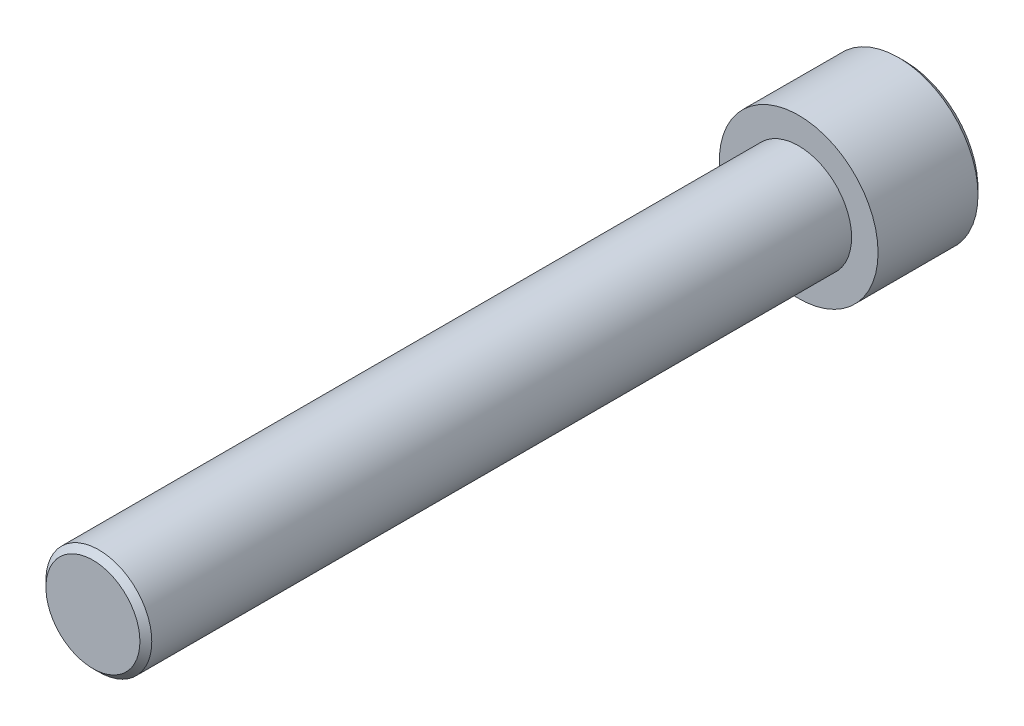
SolidWorks part; units mm, degrees
ref_plane "Front Plane" through (0, 0, 0) normal (0, 0, 1) x (1, 0, 0)
ref_plane "Top Plane" through (0, 0, 0) normal (0, 1, 0) x (1, 0, 0)
ref_plane "Right Plane" through (0, 0, 0) normal (1, 0, 0) x (0, 0, -1)
sketch "Sketch1" plane through (0, 0, 0) normal (0, 1, 0) x (1, 0, 0)
  line L0 (0, -63.5) -> (4.7625, -63.5)
  line L1 (4.7625, -63.5) -> (4.7625, 0)
  line L2 (4.7625, 0) -> (7.1438, 0)
  line L3 (7.1438, 0) -> (7.1438, 9.525)
  line L4 (7.1438, 9.525) -> (0, 9.525)
  line L5 (0, -63.5) -> (0, 0)
  line L6 (0, 0) -> (0, 9.525)
  dimension "D1" = 4.7625
  dimension "D2" = 7.1437
  dimension "D3" = 9.525
  dimension "D4" = 63.5
revolve "Revolve1" add sketch "Sketch1" angle 360 about L5
sketch "Sketch2" plane through (0, 0, -9.525) normal (0, 0, -1) x (-1, 0, 0)
  line L1 (-3.9782, -2.275) -> (-0.0189, -4.5827)
  line L2 (-0.0189, -4.5827) -> (3.9593, -2.3077)
  line L3 (3.9593, -2.3077) -> (3.9782, 2.275)
  line L4 (3.9782, 2.275) -> (0.0189, 4.5827)
  line L5 (0.0189, 4.5827) -> (-3.9593, 2.3077)
  line L6 (-3.9593, 2.3077) -> (-3.9782, -2.275)
  circle A0 centre (0, 0) radius 3.9688 construction
  circle A1 centre (0, 0) radius 7.1438 construction
  dimension "D1" = 7.9375
extrude "Cut-Extrude1" cut sketch "Sketch2" against normal blind 6.35
chamfer "Chamfer2" distance 0.5334 angle 45 1 edges at (7.1438, 0, -9.525)
chamfer "Chamfer3" distance 0.5334 angle 45 1 edges at (4.7625, 0, 63.5)
